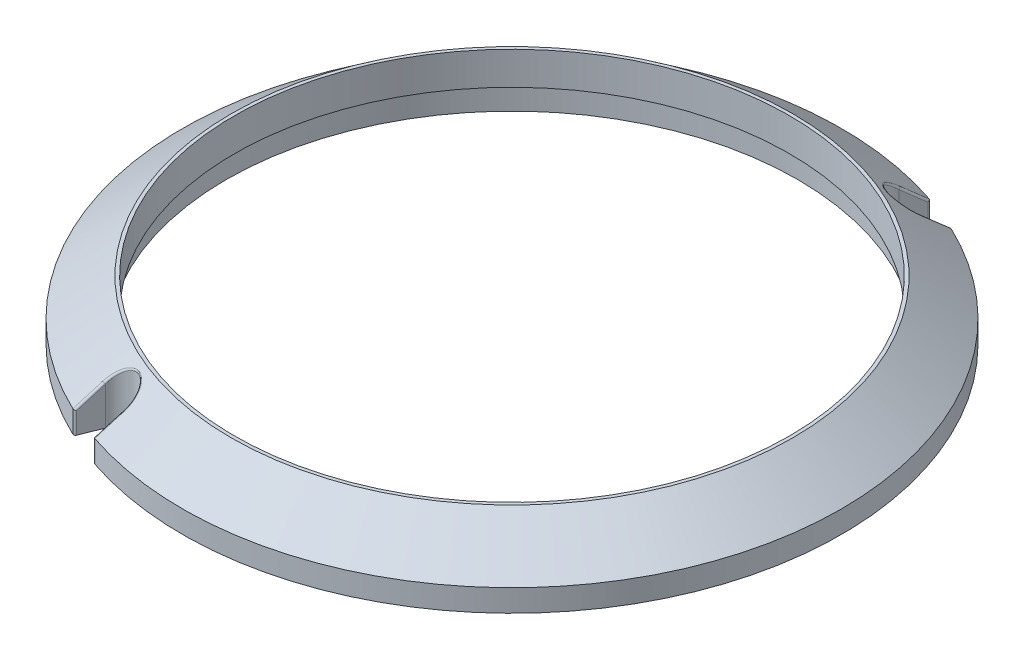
SolidWorks part; units mm, degrees
ref_plane "Front Plane" through (0, 0, 0) normal (0, 0, 1) x (1, 0, 0)
ref_plane "Top Plane" through (0, 0, 0) normal (0, 1, 0) x (1, 0, 0)
ref_plane "Right Plane" through (0, 0, 0) normal (1, 0, 0) x (0, 0, -1)
ref_axis "Axis1" through (0, 30.353, 0) along (0, -1, 0)
sketch "Sketch2" plane through (0, 0, 0) normal (0, 0, 1) x (1, 0, 0)
  line L0 (0, 0) -> (0, 77.9249) construction
  line L1 (-106.9467, 29.21) -> (-108.2167, 29.21)
  line L3 (-127, 6.35) -> (-110.0455, 6.35)
  line L4 (-110.0455, 6.35) -> (-110.0455, 16.51)
  line L5 (-110.0455, 16.51) -> (-106.9467, 16.51)
  line L6 (-106.9467, 16.51) -> (-106.9467, 29.21)
  line L7 (-127, 6.35) -> (-119.6005, 6.35) construction
  line L8 (-127, 14.8947) -> (-127, 6.35) construction
  line L24 (108.2167, 29.21) -> (-108.2167, 29.21) construction
  line L25 (-106.9467, 29.21) -> (-106.9467, 16.51) construction
  line L26 (-110.0455, 16.51) -> (-110.0455, 0) construction
  line L27 (-106.9467, 16.51) -> (106.9467, 16.51) construction
  line L28 (-127, 14.8947) -> (-108.2167, 29.21)
  line L30 (-127, 14.8947) -> (-127, 6.35)
  line L32 (-108.2167, 29.21) -> (-127, 14.8947) construction
revolve "Revolve2" add sketch "Sketch2" angle 360 about L0
sketch "Sketch3" plane through (0, 29.21, 0) normal (0, 1, 0) x (1, 0, 0)
  line L0 (-50.3655, -106.3519) -> (-53.9337, -115.1833)
  line L1 (-53.9337, -115.1833) -> (-41.2164, -120.3214)
  line L2 (-41.2164, -120.3214) -> (-37.6483, -111.49)
  line L3 (-44.0069, -108.9209) -> (-47.575, -117.7523) construction
  line L4 (0, 0) -> (-44.0069, -108.9209) construction
  circle A0 centre (0, 0) radius 127 construction
  circle A3 centre (-44.0069, -108.9209) radius 6.858
  arc A4 (-37.6483, -111.49) -> (-50.3655, -106.3519) centre (-44.0069, -108.9209) ccw
  dimension "D1" = 0.508
extrude "Cut-Extrude5" cut sketch "Sketch3" against normal through all
fillet "Fillet1" radius 0.762 5 edges at (-40.8826, 27.3587, 102.8159) (-41.147, 10.6223, 120.1496) (-53.8642, 10.6223, 115.0115)
pattern_circular "CirPattern1" count 2 over 360 about axis through (0, 30.353, 0) along (0, -1, 0) of "Cut-Extrude5", "Fillet1"
